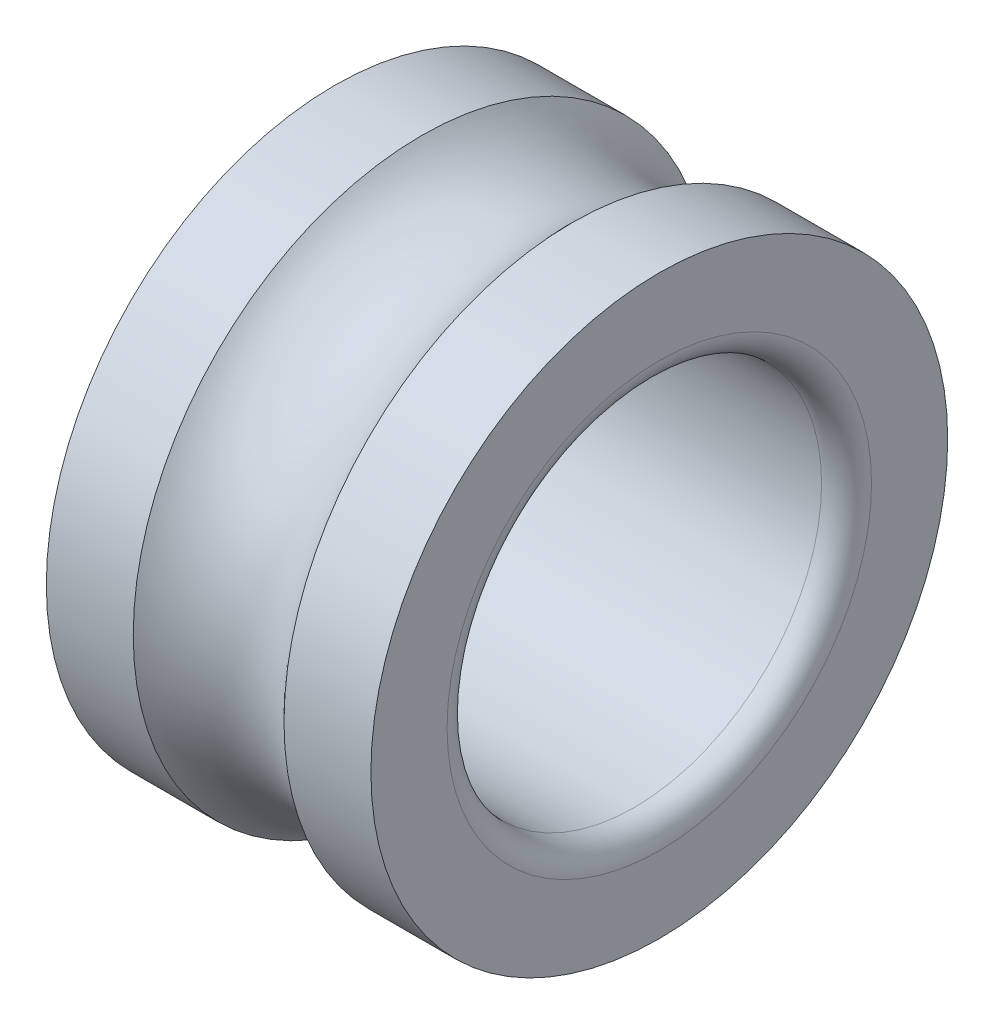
SolidWorks part; units mm, degrees
ref_plane "Plan de face" through (0, 0, 0) normal (0, 0, 1) x (1, 0, 0)
ref_plane "Plan de dessus" through (0, 0, 0) normal (0, 1, 0) x (1, 0, 0)
ref_plane "Plan de droite" through (0, 0, 0) normal (1, 0, 0) x (0, 0, -1)
sketch "Esquisse1" plane through (0, 0, 0) normal (0, 0, 1) x (1, 0, 0)
  line L0 (6.5, 21) -> (6.5, 7.5) construction
  line L1 (1, 21) -> (12, 21) construction
  line L2 (0, 20) -> (0, 8.5) construction
  line L3 (1, 7.5) -> (12, 7.5)
  line L4 (13, 20) -> (13, 8.5) construction
  line L5 (13, 16.95) -> (0, 16.95) construction
  line L6 (13, 11.55) -> (9.5187, 11.55)
  line L7 (0, 0) -> (13, 0) construction
  line L8 (13, 11.55) -> (13, 8.5)
  line L9 (0, 11.55) -> (0, 8.5)
  line L10 (3.4813, 11.55) -> (0, 11.55)
  arc A1 (0, 8.5) -> (1, 7.5) centre (1, 8.5) ccw
  arc A2 (1, 21) -> (0, 20) centre (1, 20) ccw construction
  arc A3 (13, 20) -> (12, 21) centre (12, 20) ccw construction
  arc A4 (12, 7.5) -> (13, 8.5) centre (12, 8.5) ccw
  arc A5 (3.4813, 11.55) -> (9.5187, 11.55) centre (6.5, 14.25) ccw
  dimension "D4" = 1
  dimension "D5" = 8.1
  dimension "D1" = 7.5
  dimension "D2" = 21
  dimension "D3" = 13
  dimension "D6" = 11.55
  dimension "D7" = 16.95
revolve "Révolution1" add sketch "Esquisse1" angle 360 about L7
